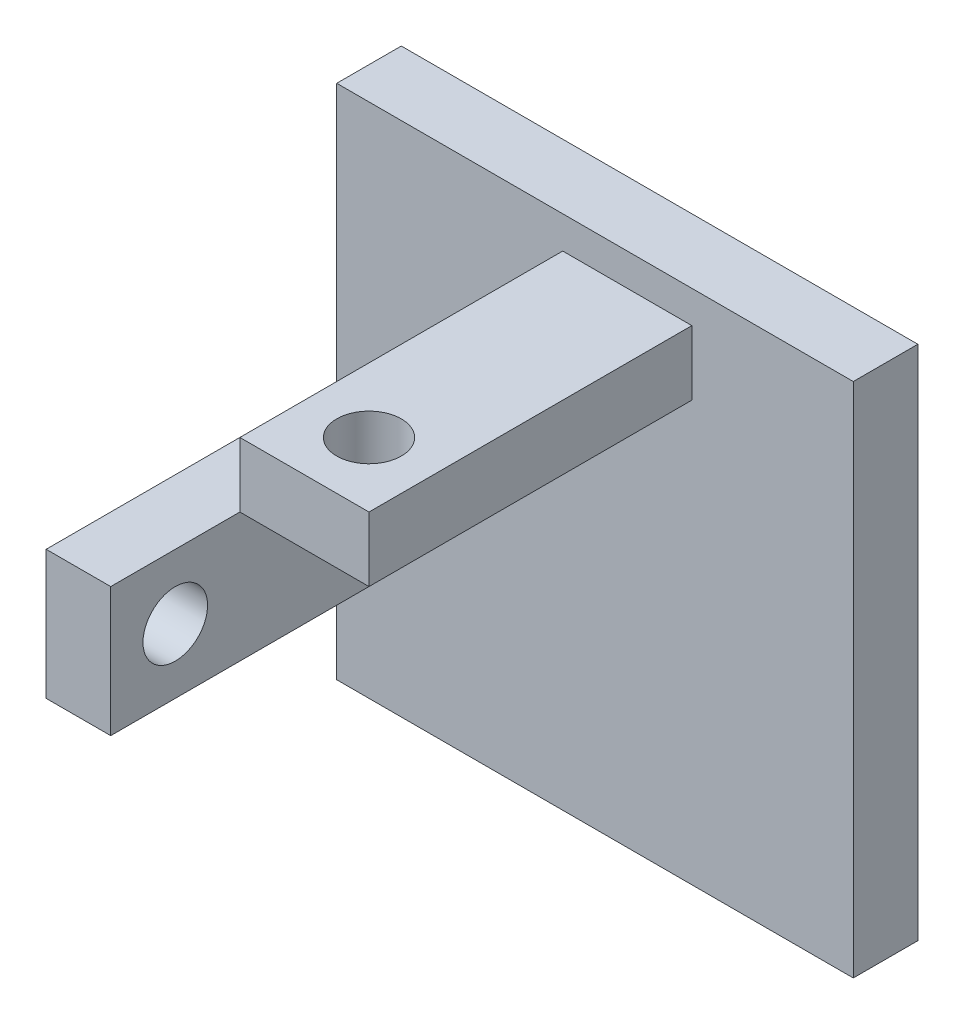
SolidWorks part; units mm, degrees
ref_plane "Plane1" through (0, 0, 0) normal (0, 0, 1) x (1, 0, 0)
ref_plane "Plane2" through (0, 0, 0) normal (0, 1, 0) x (1, 0, 0)
ref_plane "Plane3" through (0, 0, 0) normal (1, 0, 0) x (0, 0, -1)
imported_body "Imported1"
scale "Scale1" scale about centroid uniform scaling yes scale factor 2.5
